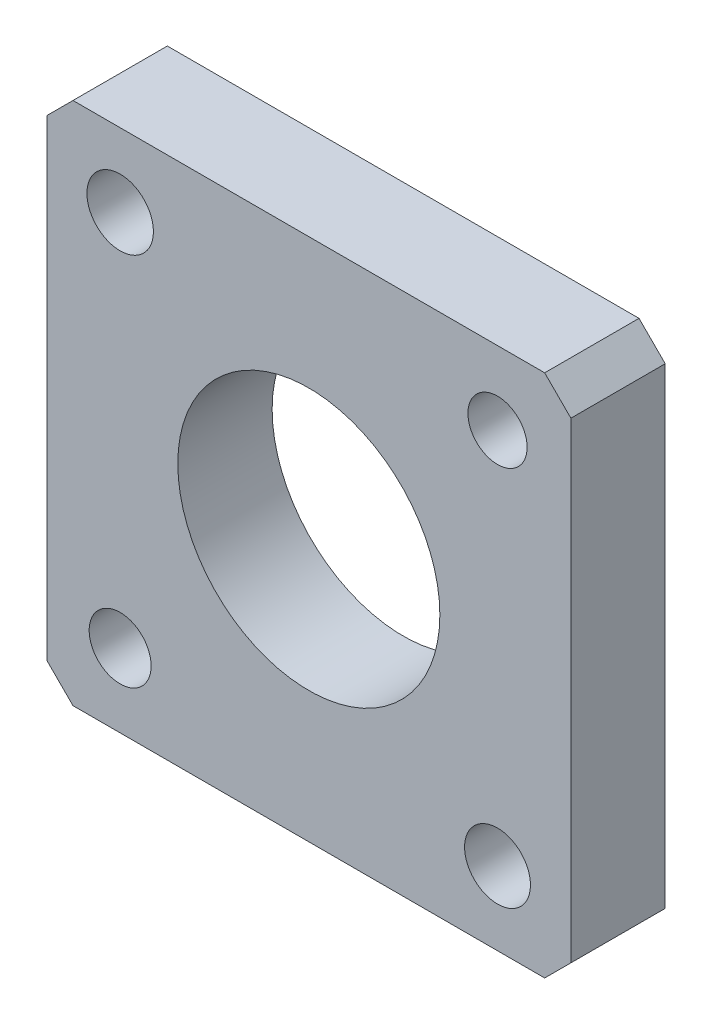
SolidWorks part; units mm, degrees
ref_plane "Face" through (0, 0, 0) normal (0, 0, 1) x (1, 0, 0)
ref_plane "Dessus" through (0, 0, 0) normal (0, 1, 0) x (1, 0, 0)
ref_plane "Droite" through (0, 0, 0) normal (1, 0, 0) x (0, 0, -1)
sketch "Esquisse1" plane through (0, 0, 0) normal (0, 0, 1) x (1, 0, 0)
  line L1 (-90.1208, 73.2625) -> (9.8792, 73.2625)
  line L2 (-90.1208, 73.2625) -> (-90.1208, -26.7375)
  line L3 (-90.1208, -26.7375) -> (9.8792, -26.7375)
  line L4 (9.8792, 73.2625) -> (9.8792, -26.7375)
  dimension "D1" = 100
  dimension "D2" = 100
extrude "Base-Extrusion" add sketch "Esquisse1" along normal blind 18
chamfer "Chanfrein1" distance 5 angle 45
sketch "Esquisse2" plane through (0, 0, 18) normal (0, 0, 1) x (1, 0, 0)
  line L0 (-85.1208, -26.7375) -> (4.8792, -26.7375) construction
  line L1 (-90.1208, 68.2625) -> (-90.1208, -21.7375) construction
  circle A0 centre (-40.1208, 23.2625) radius 25
  circle A1 centre (-4.1208, 59.2625) radius 5.6483
  circle A2 centre (-76.1208, 59.2625) radius 6.3441
  circle A3 centre (-76.1208, -12.7375) radius 5.9095
  circle A4 centre (-4.1208, -12.7375) radius 6.2848
  dimension "D1" = 50
  dimension "D7" = 36
  dimension "D2" = 72
  dimension "D3" = 50
  dimension "D4" = 50
  dimension "D5" = 36
  dimension "D6" = 36
  dimension "D8" = 36
  dimension "D9" = 36
  dimension "D10" = 36
  dimension "D11" = 36
extrude "Enlèv. mat.-Extru.1" cut sketch "Esquisse2" against normal blind 18
